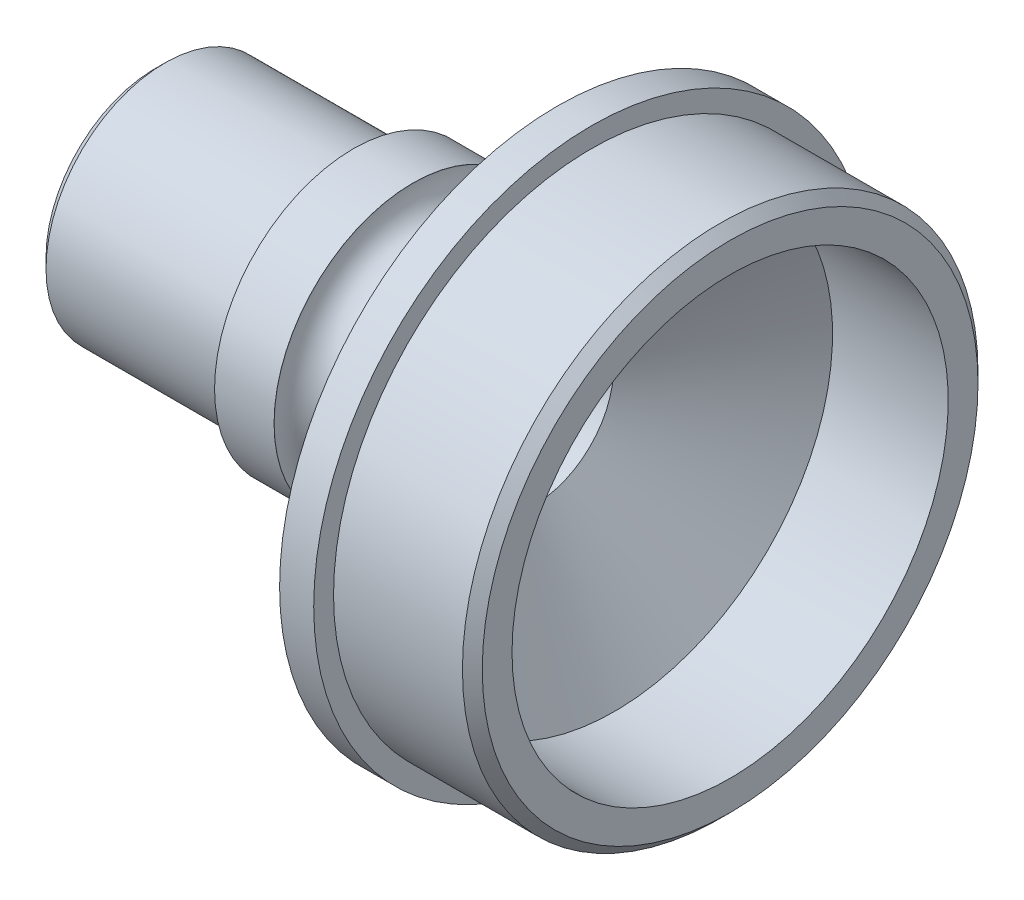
SolidWorks part; units mm, degrees
ref_plane "Plane1" through (0, 0, 0) normal (0, 0, 1) x (1, 0, 0)
ref_plane "Plane2" through (0, 0, 0) normal (0, 1, 0) x (1, 0, 0)
ref_plane "Plane3" through (0, 0, 0) normal (1, 0, 0) x (0, 0, -1)
sketch "Esquisse1" plane through (0, 0, 0) normal (0, 0, 1) x (1, 0, 0)
  line L0 (0, 0) -> (43.3446, 0) construction
  line L1 (0, 32.0545) -> (0, -12.543) construction
  line L2 (-1.7201, 14) -> (0, 14)
  line L3 (0, 14) -> (0, 13)
  line L4 (0, 13) -> (7, 13)
  line L5 (7, 13) -> (7, 11)
  line L6 (7, 11) -> (1.1666, 11)
  line L7 (1.1666, 11) -> (-2.8748, 4)
  line L8 (-2.8748, 4) -> (-22, 4)
  line L9 (-22, 4) -> (-22, 6)
  line L10 (-22, 6) -> (-12, 6)
  line L11 (-12, 6) -> (-12, 7)
  line L12 (-12, 7) -> (-9, 7)
  line L13 (-9, 7) -> (-9, 6.989)
  line L15 (-6.1334, 6.356) -> (-1.7201, 14)
  line L16 (-6.1401, 6.356) -> (-6.1334, 6.356)
  arc A0 (-9, 6.989) -> (-6.1401, 6.356) centre (-7.5, 6.989) ccw
  dimension "D11" = 3
  dimension "D1" = 60
  dimension "D2" = 13
  dimension "D3" = 7
  dimension "D4" = 14
  dimension "D5" = 11
  dimension "D6" = 6
  dimension "D7" = 4
  dimension "D8" = 22
  dimension "D9" = 10
  dimension "D10" = 3
  dimension "D12" = 4
  dimension "D13" = 7
revolve "Base-Révolution" add sketch "Esquisse1" angle 360 about L0
chamfer "Chanfrein1" distance 0.5 angle 45
chamfer "Chanfrein2" distance 0.5 angle 45
